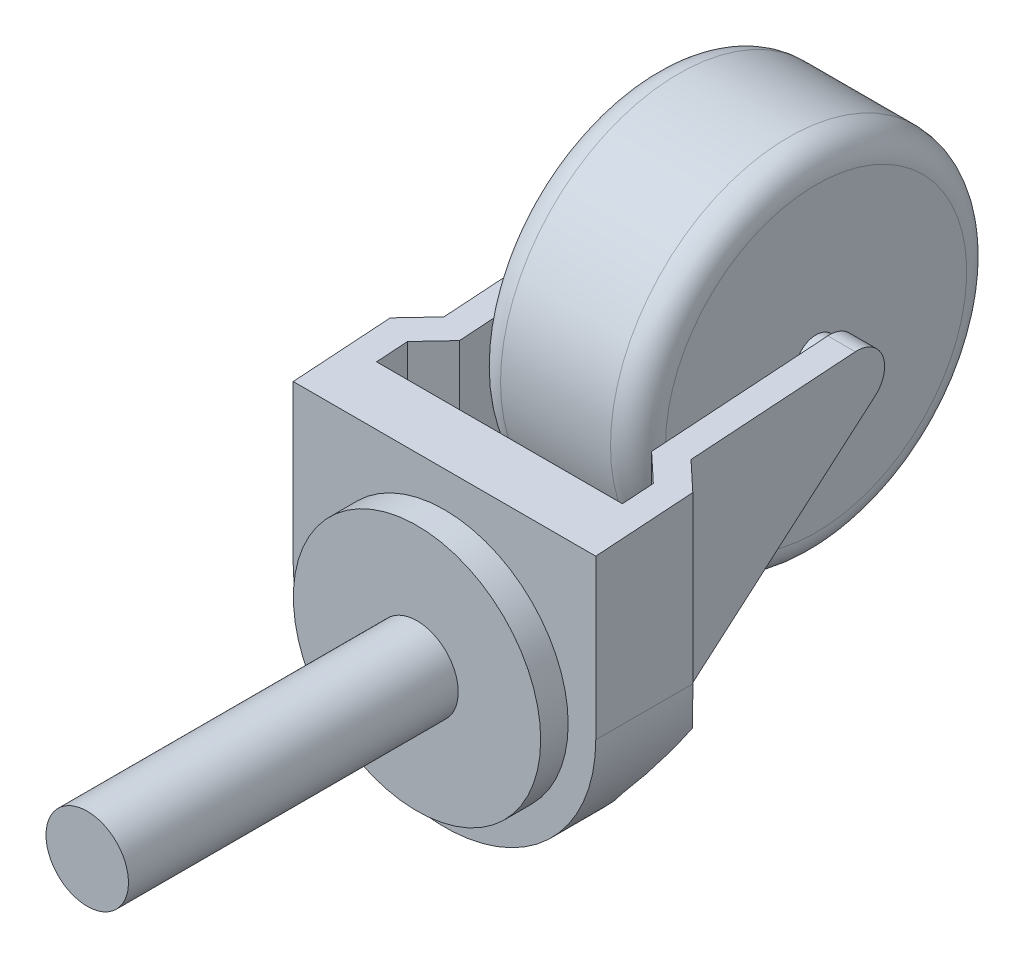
SolidWorks part; units mm, degrees
ref_plane "Front"
ref_plane "Top" through (0, 0, 0) normal (0, 1, 0) x (1, 0, 0)
ref_plane "Right" through (0, 0, 0) normal (1, 0, 0) x (0, 0, -1)
sketch "Sketch1" plane through (0, 0, 0) normal (0, 0, 1) x (1, 0, 0)
  circle A0 centre (0, 0) radius 4.7625
  dimension "D1" = 9.525
extrude "Extrude1" add sketch "Sketch1" along normal blind 38.1
sketch "Sketch2" plane through (0, 0, 0) normal (0, 0, 1) x (1, 0, 0)
  circle A0 centre (0, 0) radius 14.2875
  dimension "D1" = 28.575
extrude "Extrude2" add sketch "Sketch2" against normal blind 3.175
sketch "Sketch3" plane through (0, 0, -3.175) normal (0, 0, -1) x (-1, 0, 0)
  line L0 (-17.4752, 20.6375) -> (-17.4752, 0)
  line L1 (17.4752, 0) -> (17.4752, 20.6375)
  line L2 (17.4752, 20.6375) -> (-17.4752, 20.6375)
  arc A1 (-17.4752, 0) -> (17.4752, 0) centre (0, 0) ccw
  circle A3 centre (0, 0) radius 14.2875 construction
  circle A4 centre (0, 0) radius 14.2875 construction
  dimension "D1" = 6.35
  dimension "D2" = 17.4752
extrude "Extrude3" add sketch "Sketch3" along normal blind 36.576
sketch "Sketch4" plane through (0, 20.6375, 0) normal (0, 1, 0) x (-1, 0, 0)
  line L0 (14.1998, -9.525) -> (-14.1998, -9.525)
  line L1 (-14.1998, -9.525) -> (-14.1998, -13.1011)
  line L3 (-14.1998, -13.1011) -> (-11.0955, -16.0044)
  line L4 (-11.0955, -16.0044) -> (-11.0955, -39.751)
  line L6 (17.4752, -39.751) -> (-17.4752, -39.751) construction
  line L8 (-11.0955, -39.751) -> (-14.2705, -39.751)
  line L9 (-14.2705, -39.751) -> (-14.2705, -17.3822)
  line L10 (-14.2705, -17.3822) -> (-20.0457, -11.9811)
  line L11 (-20.0457, -11.9811) -> (-20.0457, -44.7643)
  line L12 (-20.0457, -44.7643) -> (20.0457, -44.7643)
  line L13 (17.4752, -3.175) -> (-17.4752, -3.175) construction
  line L14 (20.0457, -11.9811) -> (20.0457, -44.7643)
  line L15 (14.2705, -17.3822) -> (20.0457, -11.9811)
  line L16 (0, 0) -> (0, -59.6864) construction
  line L17 (0, 38.1) -> (0, 0) construction
  line L18 (14.2705, -39.751) -> (14.2705, -17.3822)
  line L19 (11.0955, -39.751) -> (14.2705, -39.751)
  line L20 (11.0955, -16.0044) -> (11.0955, -39.751)
  line L21 (14.1998, -13.1011) -> (11.0955, -16.0044)
  line L22 (14.1998, -9.525) -> (14.1998, -13.1011)
  point P15 (0, -44.7643)
  point P27 (0, -9.525)
  dimension "D1" = 3.175
  dimension "D2" = 6.35
  dimension "D3" = 3.175
extrude "Cut-Extrude1" cut sketch "Sketch4" against normal through all
sketch "Sketch5" plane through (17.4752, 0, 0) normal (1, 0, 0) x (0, 0, -1)
  line L0 (0, 14.2875) -> (0, -14.2875) construction
  line L3 (14.385, 20.6375) -> (3.175, 20.6375) construction
  line L4 (36.3605, 20.6302) -> (3.175, 18.3722)
  line L5 (3.175, 20.6375) -> (3.175, 0) construction
  line L6 (38.6488, 15.0575) -> (9.525, -10.0442)
  line L7 (9.525, -10.0442) -> (9.525, -25.1124)
  line L8 (9.525, -25.1124) -> (43.8303, -25.1124)
  line L11 (43.8303, -25.1124) -> (43.8303, 27.5109)
  line L12 (43.8303, 27.5109) -> (3.175, 27.5109)
  line L13 (3.175, 27.5109) -> (3.175, 18.3722)
  arc A0 (38.6488, 15.0575) -> (36.3605, 20.6302) centre (36.576, 17.4625) ccw
  dimension "D1" = 36.576
  dimension "D2" = 6.35
extrude "Cut-Extrude2" cut sketch "Sketch5" against normal through all
ref_plane "Plane2" through (0, 17.4625, 0) normal (0, 1, 0) x (-1, 0, 0)
sketch "Sketch7" plane through (0, 17.4625, 0) normal (0, 1, 0) x (-1, 0, 0)
  line L0 (14.2705, -36.576) -> (-12.215, -36.576) construction
  line L1 (9.525, -19.177) -> (9.525, -36.576)
  line L2 (-9.525, -19.177) -> (-9.525, -36.576)
  line L4 (-6.35, -16.002) -> (6.35, -16.002)
  line L6 (9.525, -36.576) -> (-9.525, -36.576)
  line L9 (14.2705, -36.576) -> (11.0955, -36.576) construction
  arc A1 (-6.35, -16.002) -> (-9.525, -19.177) centre (-6.35, -19.177) ccw
  arc A2 (6.35, -16.002) -> (9.525, -19.177) centre (6.35, -19.177) cw
  dimension "D1" = 20.574
  dimension "D2" = 19.05
  dimension "D3" = 3.175
revolve "Revolve1" add sketch "Sketch7" angle 360 about L0
sketch "Sketch8" plane through (14.2705, 0, 0) normal (1, 0, 0) x (0, 0, -1)
  circle A0 centre (36.576, 17.4625) radius 2.3812
  arc A2 (38.6488, 15.0575) -> (36.3605, 20.6302) centre (36.576, 17.4625) ccw construction
  dimension "D1" = 4.7625
extrude "Extrude5" add sketch "Sketch8" against normal up to surface (28.5409 mm away)
